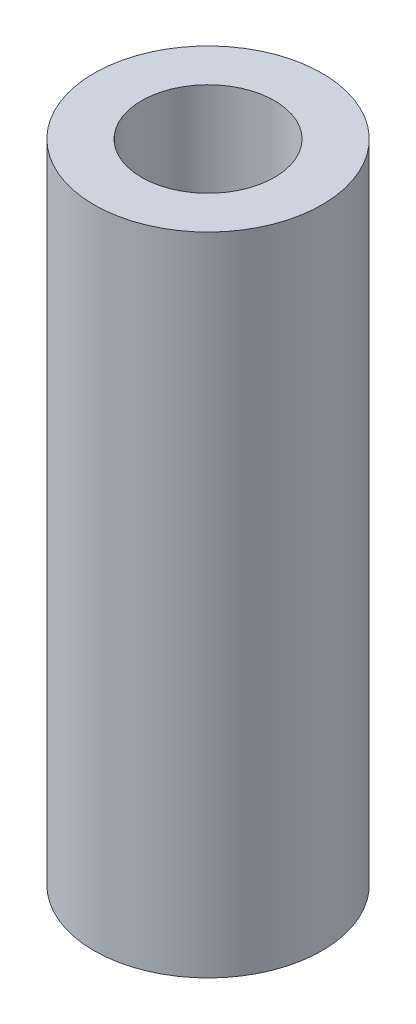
SolidWorks part; units mm, degrees
ref_plane "Front" through (0, 0, 0) normal (0, 0, 1) x (1, 0, 0)
ref_plane "Top" through (0, 0, 0) normal (0, 1, 0) x (1, 0, 0)
ref_plane "Right" through (0, 0, 0) normal (1, 0, 0) x (0, 0, -1)
sketch "Sketch1" plane through (0, 0, 0) normal (0, 1, 0) x (1, 0, 0)
  circle A0 centre (0, 0) radius 3
  circle A1 centre (0, 0) radius 1.75
extrude "Extrude1" add sketch "Sketch1" along normal blind 17
